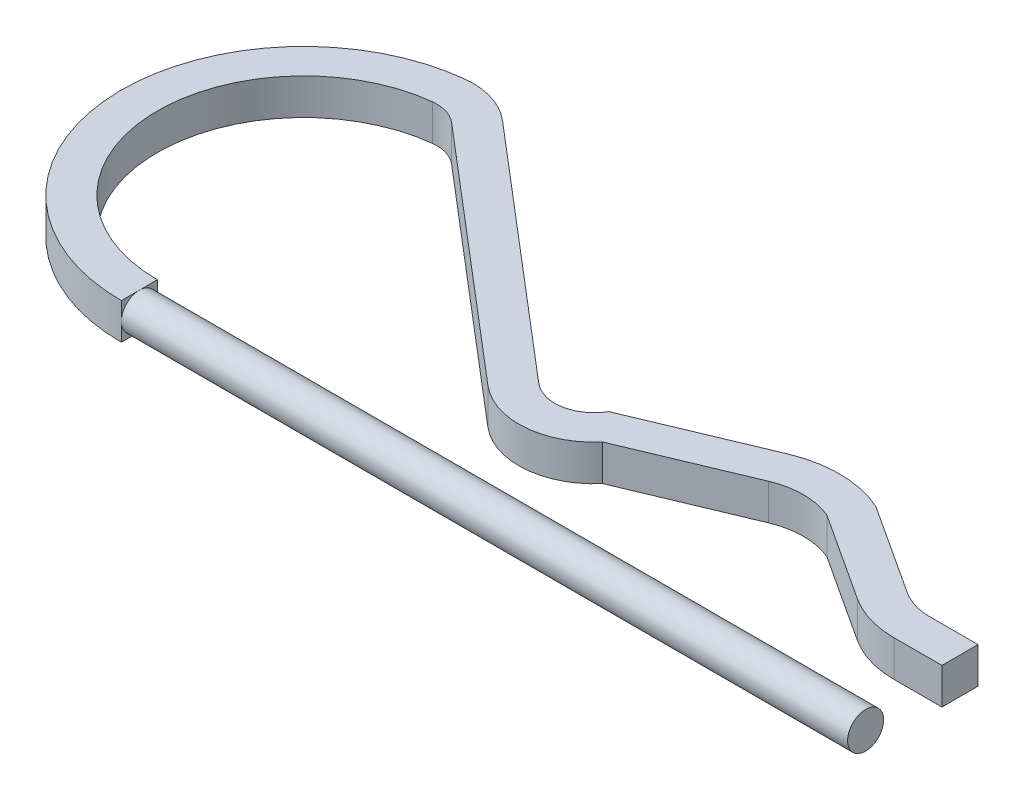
SolidWorks part; units mm, degrees
ref_plane "Front Plane" through (0, 0, 0) normal (0, 0, 1) x (1, 0, 0)
ref_plane "Top Plane" through (0, 0, 0) normal (0, 1, 0) x (1, 0, 0)
ref_plane "Right Plane" through (0, 0, 0) normal (1, 0, 0) x (0, 0, -1)
sketch "Sketch1" plane through (0, 0, 0) normal (0, 1, 0) x (1, 0, 0)
  line L0 (-51.1437, -2.54) -> (-51.1437, 0)
  line L1 (-50.3732, 19.949) -> (-33.0581, 5.1885)
  line L2 (-25.5718, 5.7847) -> (-17.3444, 9.2297)
  line L3 (-13.2311, 9.2297) -> (-7.0361, 5.1885)
  line L4 (-3.3918, 4.1049) -> (0, 4.1049)
  line L6 (-48.7255, 21.8819) -> (-31.4103, 7.1215)
  line L7 (-27.2091, 7.8528) -> (-18.3254, 11.5726)
  line L8 (-12.0179, 11.471) -> (-5.6483, 7.3159)
  line L9 (-3.3918, 6.6449) -> (0, 6.6449)
  line L10 (0, 6.6449) -> (0, 4.1049)
  line L13 (0, 0) -> (-51.1437, 0) construction
  line L14 (0, -2.54) -> (-51.1437, -2.54) construction
  arc A0 (-51.1437, 0) -> (-52.3081, 20.5397) centre (-51.1437, 10.3029) cw
  arc A1 (-33.0581, 5.1885) -> (-25.5718, 5.7847) centre (-29.6131, 9.2297) ccw
  arc A2 (-17.3444, 9.2297) -> (-13.2311, 9.2297) centre (-15.2877, 4.318) cw
  arc A3 (-7.0361, 5.1885) -> (-3.3918, 4.1049) centre (-3.3918, 10.7749) ccw
  arc A4 (-52.3081, 20.5397) -> (-50.3732, 19.949) centre (-52.021, 18.016) cw
  arc A5 (-51.1437, -2.54) -> (-52.5952, 23.0634) centre (-51.1437, 10.3029) cw
  arc A6 (-52.5952, 23.0634) -> (-48.7255, 21.8819) centre (-52.021, 18.016) cw
  arc A7 (-31.4103, 7.1215) -> (-27.2091, 7.8528) centre (-29.6131, 9.2297) ccw
  arc A8 (-18.3254, 11.5726) -> (-12.0179, 11.471) centre (-15.2877, 4.318) cw
  arc A9 (-5.6483, 7.3159) -> (-3.3918, 6.6449) centre (-3.3918, 10.7749) ccw
  point P33 (-76.1505, 4.6762)
  dimension "D1" = 2.54
  dimension "D2" = 10.3029
  dimension "D3" = 5.3103
  dimension "D4" = 5.3249
  dimension "D5" = 6.67
  dimension "D6" = 3.3918
  dimension "D7" = 7.0361
  dimension "D8" = 13.2311
  dimension "D9" = 15.2877
  dimension "D10" = 25.5718
  dimension "D11" = 50.3732
  dimension "D12" = 51.1437
  dimension "D13" = 2.54
extrude "Extrude1" add sketch "Sketch1" along normal blind 2.54
sketch "Sketch3" plane through (-51.1437, 0, 0) normal (1, 0, 0) x (0, 0, -1)
  line L0 (-2.54, 0) -> (0, 0) construction
  circle A0 centre (-1.27, 1.27) radius 1.27
  dimension "D1" = 2.54
  dimension "D2" = 1.27
  dimension "D3" = 1.27
extrude "Extrude2" add sketch "Sketch3" along normal through all
